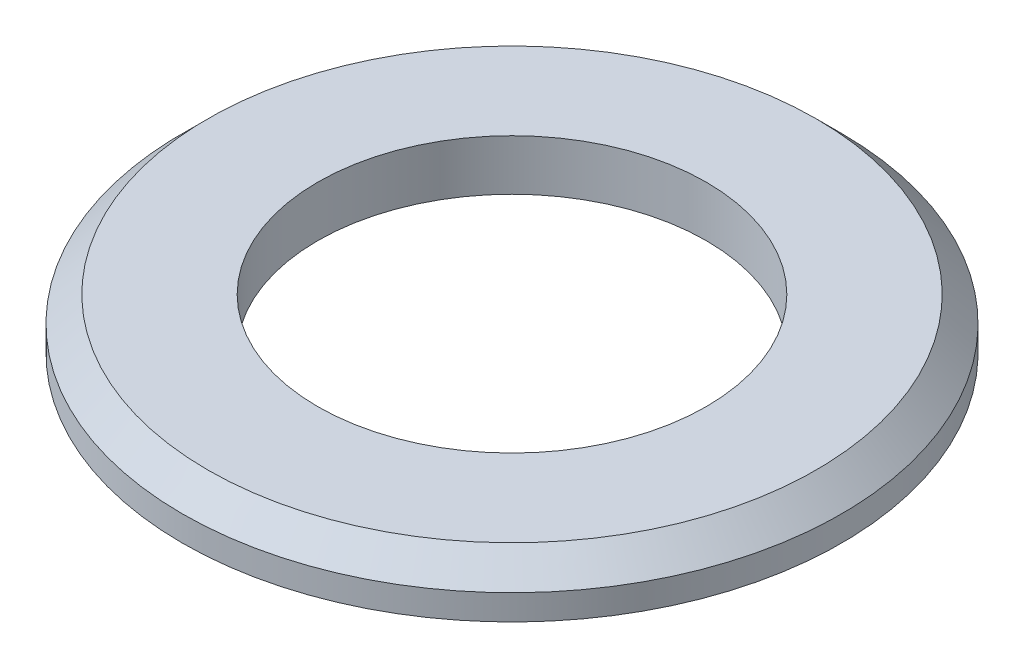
SolidWorks part; units mm, degrees
ref_plane "Front" through (0, 0, 0) normal (0, 0, 1) x (1, 0, 0)
ref_plane "Top" through (0, 0, 0) normal (0, 1, 0) x (1, 0, 0)
ref_plane "Right" through (0, 0, 0) normal (1, 0, 0) x (0, 0, -1)
sketch "Sketch1" plane through (0, 0, 0) normal (0, 1, 0) x (1, 0, 0)
  circle A0 centre (0, 0) radius 11.5
  circle A1 centre (0, 0) radius 19.5
extrude "Extrude1" add sketch "Sketch1" along normal blind 3
chamfer "Chamfer1" distance 1.5 1 edges at (0, 3, 19.5)
